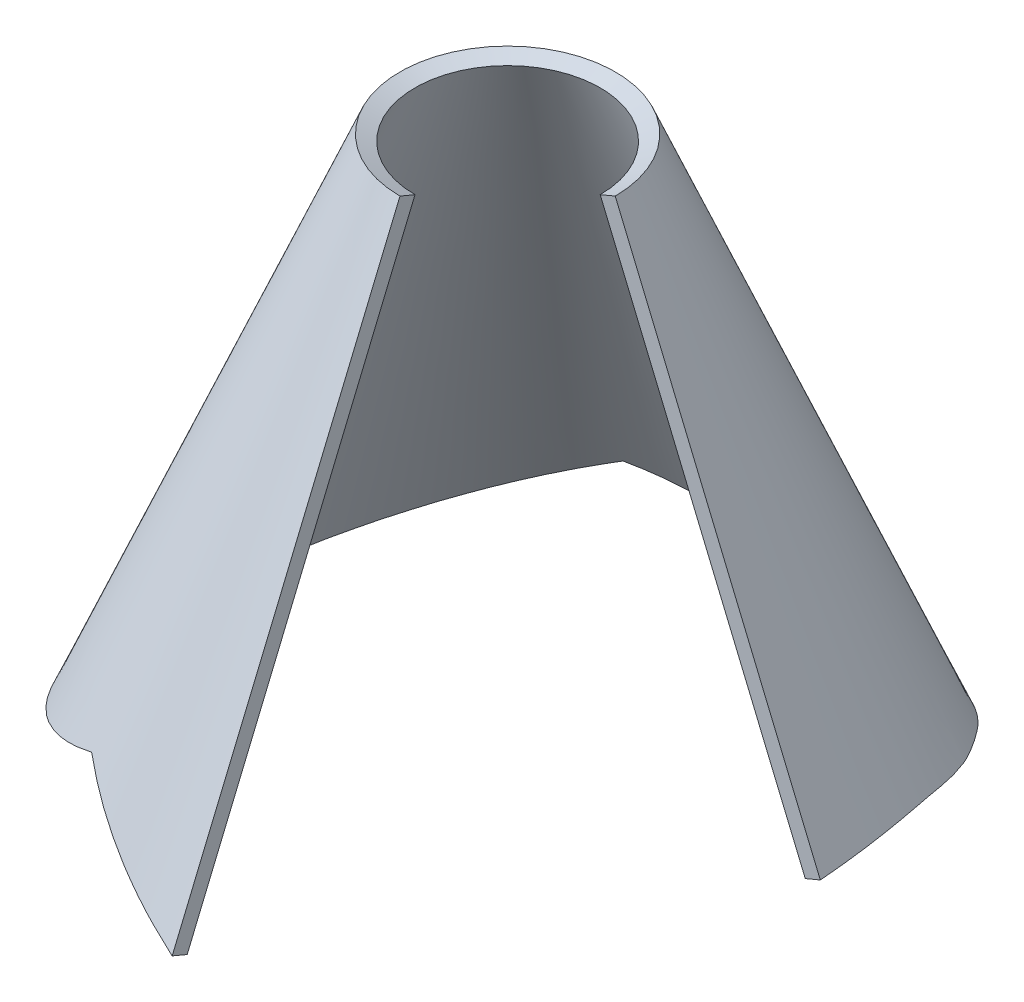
SolidWorks part; units mm, degrees
ref_plane "Vorderansicht" through (0, 0, 0) normal (0, 0, 1) x (1, 0, 0)
ref_plane "Draufsicht" through (0, 0, 0) normal (0, 1, 0) x (1, 0, 0)
ref_plane "Seitenansicht" through (0, 0, 0) normal (1, 0, 0) x (0, 0, -1)
sketch "Skizze1" plane through (0, 0, 0) normal (0, 0, 1) x (1, 0, 0)
  line L0 (46.7774, 0) -> (11.3783, 84.5469)
  line L1 (0, 0) -> (0, 89.92) construction
revolve "Rotation-Dünn1" add sketch "Skizze1" angle 270 about L1
sheet metal parameters "Blech1" parameters "D1"=5, "Dicke"=2
bend "Biegung-Rundung1" bend radius 46.7774
flatten bends "Abwickeln1" parameters "D1"=0, "D4"=270, "D5"=1
sketch "Skizze-Winkel1" plane through (23.9756, 54.4596, 0) normal (-0.9224, -0.3862, 0) x (0, 0, 1)
  line L0 (-25.1453, 44.9198) -> (-76.6486, 4.8801) construction
sketch "Skizze7" plane through (0, 0, 0) normal (0, 0, 1) x (1, 0, 0)
  line L1 (-53.0139, 8.3117) -> (-17.2087, 26.2143)
  line L2 (-17.2087, 26.2143) -> (12.4902, 11.5036)
  line L3 (12.4902, 11.5036) -> (48.8505, 30.9328)
extrude "Schnitt-Linear austragen3" cut sketch "Skizze7" against normal through all and the other way through all flip side to cut
process bends "Abbiegen1" parameters "D1"=0
sketch "Abwicklung-Skizze1" plane through (39.8003, 16.664, 0) normal (-0.9224, -0.3862, 0) x (0, 0, 1)
